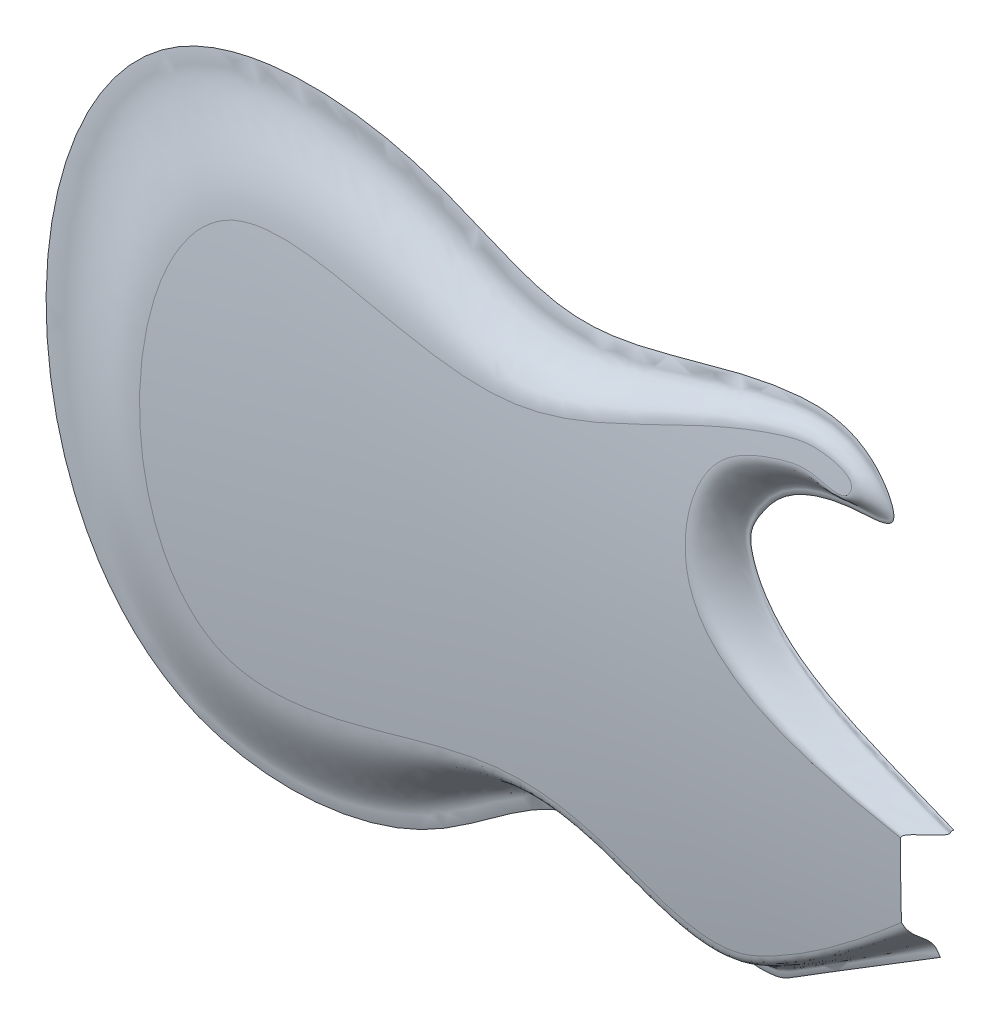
SolidWorks part; units mm, degrees
ref_plane "Front Plane" through (0, 0, 0) normal (0, 0, 1) x (1, 0, 0)
ref_plane "Top Plane" through (0, 0, 0) normal (0, 1, 0) x (1, 0, 0)
ref_plane "Right Plane" through (0, 0, 0) normal (1, 0, 0) x (0, 0, -1)
sketch "Sketch1" plane through (0, 0, 0) normal (0, 1, 0) x (1, 0, 0)
  line L0 (-380.9748, -51.9303) -> (97.4564, -30.6197) construction
  line L2 (-188.0816, 0) -> (188.0816, 0) construction
  line L3 (-592.5941, 1082.777) -> (269.486, 1121.1762) construction
  arc A0 (-380.9748, -51.9303) -> (97.4564, -30.6197) centre (-241.9267, 2207.5326) ccw
  point P2 (72.0815, -31.75)
  point P5 (-355.6, -50.8)
  dimension "D1" = 25.4
  dimension "D2" = 25.4
  dimension "D3" = 30.6197
  dimension "D4" = 97.4564
  dimension "D5" = 2.55
  dimension "D6" = 478.4312
  dimension "D7" = 12.7
  dimension "D8" = 1143
surface "Surface-Revolve1" sketch "Sketch1" parameters "D1"=30
ref_plane "Angled Plane" through (1.5542, 0, 34.8915) normal (0.0445, 0, 0.999) x (0.999, 0, -0.0445)
ref_plane "Plane1" through (0.989, 0, 22.204) normal (0.0445, 0, 0.999) x (0.999, 0, -0.0445)
sketch "Sketch2" plane through (-96.4883, 26.5703, 0) normal (0, 0, 1) x (1, 0, 0)
  line L1 (95.7101, 5.1797) -> (-196.7425, 5.1797) construction
  line L2 (-153.235, 105.762) -> (-153.235, -95.4025) construction
  line L3 (-65.0331, -89.9675) -> (-65.0331, 100.327) construction
  line L4 (-196.7425, 5.1797) -> (-260.2425, 5.1797) construction
  spline S0 degree 3 poles (207.7093, -26.5703) (148.9299, -5.4191) (71.935, 22.2868) (91.5633, 113.7917) (123.9586, 123.4584) (142.7496, 125.8642) (158.7707, 116.9684) (163.7795, 128.6124) (145.0344, 136.8672) (122.7071, 134.0197) (72.0163, 118.2186) (10.7256, 85.4574) (-70.8597, 100.4467) (-171.2577, 127.8192) (-210.7031, 4.9736) (-171.2932, -116.7149) (-66.5757, -90.9043) (-1.1762, -72.3825) (57.9574, -91.1798) (97.6769, -120.898) (155.3598, -95.4036) (183.8897, -70.5749) (207.7093, -49.8455) knots 0 0 0 0 0.128417 0.168213 0.191991 0.205462 0.220099 0.221295 0.235526 0.252941 0.284296 0.364515 0.419541 0.493426 0.585025 0.676623 0.750509 0.814713 0.847251 0.905045 0.920723 1 1 1 1
  dimension "D2" = 63.5
surface "Top Shape Trim"
sketch "Sketch3" plane through (0.989, 0, 22.204) normal (0.0445, 0, 0.999) x (0.999, 0, -0.0445)
  line L2 (29.1269, -97.8003) -> (104.2908, -52.1742) construction
  spline S1 degree 3 number of poles 252 (29.1269, -97.8003) -> (76.5867, 152.7438) construction
  spline S2 degree 3 number of poles 304 (110.6938, 8.1763) -> (104.2908, -52.1742)
  spline S3 degree 3 poles (76.5867, 152.7438) (77.0116, 152.023) (77.4158, 151.288) (78.1933, 149.7377) (78.5639, 148.9193) (79.2069, 147.255) (79.4824, 146.4068) (79.7761, 145.0925) (79.8529, 144.6501) (79.923, 143.9829) (79.9388, 143.7596) (79.9519, 143.3111) (79.9492, 143.0852) (79.9071, 142.4148) (79.8353, 141.9747) (79.5574, 141.1152) (79.3552, 140.7152) (78.8011, 139.9986) (78.4665, 139.6994) (77.7203, 139.1896) (77.3227, 138.9873) (76.4981, 138.6462) (76.0681, 138.5075) (75.2059, 138.2775) (74.7724, 138.1854) (73.467, 137.9542) (72.5904, 137.8587) (70.8312, 137.7244) (69.9485, 137.6867) (67.2957, 137.6172) (65.5204, 137.6282) (61.9713, 137.6325) (60.198, 137.626) (54.9028, 137.4324) (51.4013, 137.1025) (44.4679, 135.955) (41.0357, 135.1388) (36.8018, 133.7239) (35.9578, 133.4209) (34.2761, 132.7717) (33.4415, 132.4266) (30.978, 131.3356) (29.3812, 130.5312) (26.2852, 128.7568) (24.7861, 127.7868) (22.6175, 126.196) (21.908, 125.6431) (20.5172, 124.4895) (19.839, 123.8913) (17.8754, 122.0484) (16.6527, 120.7495) (14.3794, 118.0118) (13.3299, 116.572) (11.8745, 114.3155) (11.4091, 113.5472) (10.5158, 111.9803) (10.0891, 111.1837) (8.8743, 108.7783) (8.1462, 107.1459) (6.6995, 103.5299) (6.0067, 101.5373) (5.3859, 99.5193) knots 0.896592 0.896592 0.896592 0.896592 0.898438 0.898438 0.900391 0.900391 0.902344 0.902344 0.90332 0.90332 0.903809 0.903809 0.904297 0.904297 0.905273 0.905273 0.90625 0.90625 0.907227 0.907227 0.908203 0.908203 0.90918 0.90918 0.910156 0.910156 0.912109 0.912109 0.914063 0.914063 0.917969 0.917969 0.921875 0.921875 0.929688 0.929688 0.9375 0.9375 0.939453 0.939453 0.941406 0.941406 0.945313 0.945313 0.949219 0.949219 0.951172 0.951172 0.953125 0.953125 0.957031 0.957031 0.960938 0.960938 0.962891 0.962891 0.964844 0.964844 0.96875 0.96875 0.973375 0.973375 0.973375 0.973375 construction
  spline S4 degree 3 poles (5.3859, 99.5193) (3.3161, 93.0347) (11.5035, 51.9374) (81.5334, 21.0414) (110.6938, 8.1763) knots 0 0 0 0 0.583601 1 1 1 1 construction
sketch "Sketch4" plane through (0.989, 0, 22.204) normal (0.0445, 0, 0.999) x (0.999, 0, -0.0445)
  line L5 (110.6938, 8.1763) -> (104.2908, -52.1742)
  spline S0 degree 3 number of poles 304 (110.6938, 8.1763) -> (104.2908, -52.1742) construction
  spline S1 degree 3 number of poles 304 (110.6938, 8.1763) -> (104.2908, -52.1742)
surface "Construction Surface for Loft" sketch "Sketch4"
surface "Shape Loft"
delete or keep bodies "Body-Delete1" type delete bodies bodies 139
surface "Surface-Extend1" parameters "D1"=1.778
surface "Top Surface Knit"
sketch "Guitar Body Outline" plane through (0, 0, 0) normal (0, 0, 1) x (1, 0, 0)
  line L0 (0, 63.5) -> (0, 0)
  line L1 (0, 31.75) -> (-355.6, 31.75) construction
  line L2 (-286.0579, 184.15) -> (-286.0579, -120.65) construction
  line L3 (-163.7965, -118.8493) -> (-163.7965, 182.3493) construction
  spline S0 degree 3 poles (0, 63.5) (2.4707, 84.1763) (7.034, 122.3646) (46.8232, 139.9004) (87.3467, 136.0004) (67.0488, 173.6245) (2.0345, 177.7665) (-80.1818, 134.4451) (-173.9531, 195.6953) (-316.8898, 206.98) (-377.6823, 30.9941) (-317.9087, -140.8648) (-165.327, -137.5991) (-100.749, -67.3623) (-28.9342, -80.403) (20.3895, -123.3517) (55.7195, -68.503) (16.231, -73.6373) (1.1604, -36.0474) (0, -10.747) (0, 0) knots 0 0 0 0 0.044035 0.081332 0.096422 0.112661 0.147802 0.24108 0.300473 0.394246 0.522717 0.651187 0.744961 0.816316 0.847087 0.908535 0.926631 0.938591 0.975274 1 1 1 1
  dimension "D1" = 228.6
  dimension "D2" = 355.6
  dimension "D3" = 304.8
  dimension "D4" = 63.5
  dimension "D5" = 69.5421
